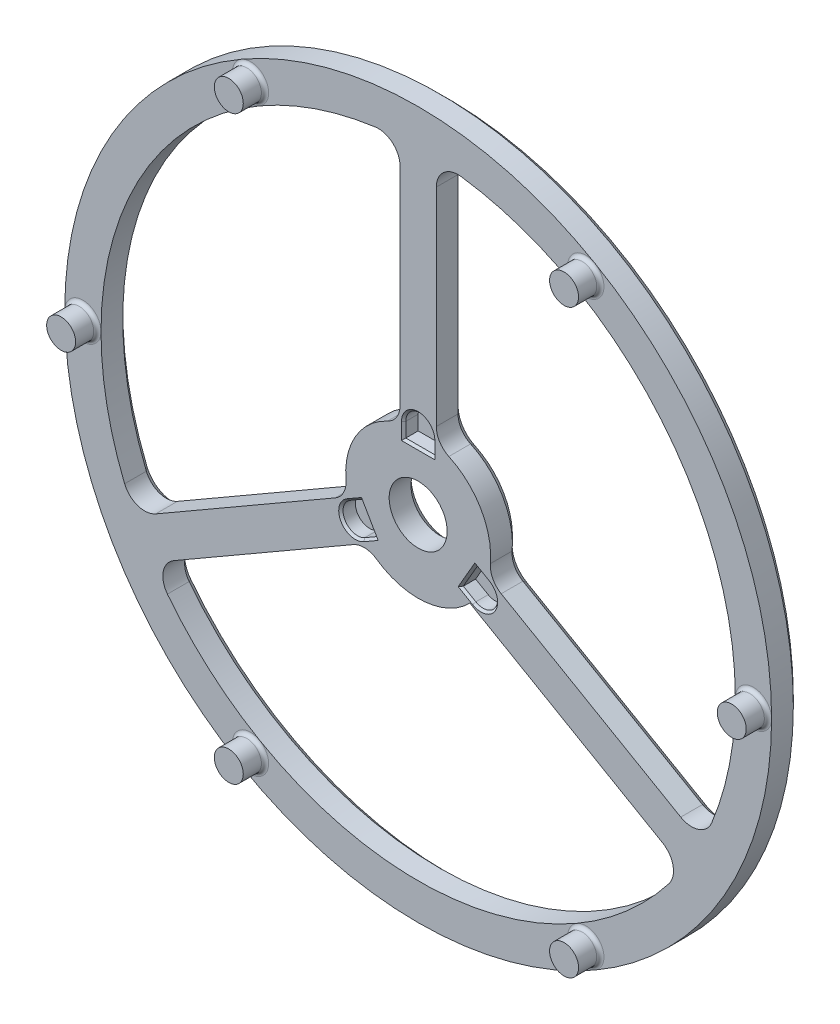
SolidWorks part; units mm, degrees
ref_plane "Front Plane" through (0, 0, 0) normal (0, 0, 1) x (1, 0, 0)
ref_plane "Top Plane" through (0, 0, 0) normal (0, 1, 0) x (1, 0, 0)
ref_plane "Right Plane" through (0, 0, 0) normal (1, 0, 0) x (0, 0, -1)
sketch "Sketch1" plane through (0, 0, 0) normal (0, 0, 1) x (1, 0, 0)
  line L0 (73.1534, -48.0086) -> (14.2705, -14.0126)
  line L2 (-5, 87.357) -> (-5, 19.3649)
  line L4 (5, 87.357) -> (5, 19.3649)
  line L5 (78.1534, -39.3484) -> (19.2705, -5.3523)
  line L6 (-78.1534, -39.3484) -> (-19.2705, -5.3523)
  line L7 (-73.1534, -48.0086) -> (-14.2705, -14.0126)
  circle A0 centre (0, 0) radius 97.5
  arc A1 (-5, 87.357) -> (-78.1534, -39.3484) centre (0, 0) ccw
  arc A2 (-5, 19.3649) -> (-19.2705, -5.3523) centre (0, 0) ccw
  circle A3 centre (0, 0) radius 87.5 construction
  arc A4 (19.2705, -5.3523) -> (5, 19.3649) centre (0, 0) ccw
  arc A5 (-14.2705, -14.0126) -> (14.2705, -14.0126) centre (0, 0) ccw
  arc A6 (78.1534, -39.3484) -> (5, 87.357) centre (0, 0) ccw
  arc A7 (-73.1534, -48.0086) -> (73.1534, -48.0086) centre (0, 0) ccw
  circle A8 centre (0, 0) radius 8
  dimension "D1" = 195
  dimension "D3" = 40
  dimension "D7" = 16
  dimension "D4" = 10
  dimension "D5" = 5
  dimension "D2" = 10
  dimension "D6" = 3
extrude "Boss-Extrude1" add sketch "Sketch1" along normal blind 8
sketch "Sketch2" plane through (0, 0, 8) normal (0, 0, 1) x (1, 0, 0)
  line L0 (0, 0) -> (0, 97.5) construction
  line L1 (0, 0) -> (84.4375, -48.75) construction
  line L2 (0, 0) -> (46.25, 80.1073) construction
  line L3 (0, 0) -> (92.5, 0) construction
  line L4 (0, 0) -> (-46.25, 80.1073) construction
  line L5 (0, 0) -> (46.25, -80.1073) construction
  circle A0 centre (0, 0) radius 97.5 construction
  circle A1 centre (46.25, 80.1073) radius 4
  circle A2 centre (92.5, 0) radius 4
  circle A7 centre (46.25, -80.1073) radius 4
  circle A8 centre (-46.25, -80.1073) radius 4
  circle A9 centre (-92.5, 0) radius 4
  circle A10 centre (-46.25, 80.1073) radius 4
  dimension "D5" = 92.5
  dimension "D6" = 8
  dimension "D7" = 8
  dimension "D10" = 30
  dimension "D1" = 120
  dimension "D2" = 30
  dimension "D3" = 60
  dimension "D4" = 92.5
  dimension "D9" = 30
  dimension "D8" = 3
extrude "Boss-Extrude2" add sketch "Sketch2" along normal blind 6
fillet "Fillet1" radius 1 6 edges at (96.5, 0, 8) (50.25, 80.1073, 8) (50.25, -80.1073, 8) (-42.25, -80.1073, 8) (-88.5, 0, 8) (-42.25, 80.1073, 8)
fillet "Fillet2" radius 6 11 edges at (78.1534, -39.3484, 4) (73.1534, -48.0086, 4) (-73.1534, -48.0086, 4) (-78.1534, -39.3484, 4) (-14.2705, -14.0126, 4) (-19.2705, -5.3523, 4) (19.2705, -5.3523, 4) (5, 19.3649, 4) (-5, 19.3649, 4) (-5, 87.357, 4) (5, 87.357, 4)
chamfer "Chamfer1" distance 2 angle 45 25 edges at (-14.642, -15.3111, 0) (1.839, -19.9153, 0) (40.8529, -29.3599, 0) (70.3226, -48.7461, 0) (0, -87.5, 0) (-70.3226, -48.7461, 0) (-42.6687, -30.4083, 0) (-5.9388, 20.3359, 0) (-17.3205, 10, 0) (-20.5808, -5.0248, 0) (-47.6687, -21.748, 0) (-77.3766, -36.5281, 0) (-75.7772, 43.75, 0) (-7.054, 85.2742, 0) (-5, 52.1563, 0) (97.5, 0, 0) (8, 0, 0) (20.5808, -5.0248, 0) (17.3205, 10, 0) (5.9388, 20.3359, 0) (5, 52.1563, 0) (7.054, 85.2742, 0) (75.7772, 43.75, 0) (77.3766, -36.5281, 0) (47.6687, -21.748, 0)
sketch "Sketch3" plane through (0, 0, 8) normal (0, 0, 1) x (1, 0, 0)
  line L3 (-4, 20) -> (-4, 16)
  line L4 (-4, 16) -> (4, 16)
  line L5 (4, 16) -> (4, 20)
  line L6 (11.8564, -11.4641) -> (15.3205, -13.4641)
  line L7 (15.8564, -4.5359) -> (11.8564, -11.4641)
  line L8 (19.3205, -6.5359) -> (15.8564, -4.5359)
  line L9 (-15.8564, -4.5359) -> (-19.3205, -6.5359)
  line L10 (-11.8564, -11.4641) -> (-15.8564, -4.5359)
  line L11 (-15.3205, -13.4641) -> (-11.8564, -11.4641)
  circle A0 centre (0, 0) radius 20 construction
  arc A1 (4, 20) -> (-4, 20) centre (0, 20) ccw
  arc A2 (15.3205, -13.4641) -> (19.3205, -6.5359) centre (17.3205, -10) ccw
  arc A3 (-19.3205, -6.5359) -> (-15.3205, -13.4641) centre (-17.3205, -10) ccw
  dimension "D1" = 8
  dimension "D4" = 4
  dimension "D2" = 3
  dimension "D3" = 3
extrude "Cut-Extrude1" cut sketch "Sketch3" against normal blind 4
chamfer "Chamfer3" distance 0.6 angle 45 12 edges at (4, 18, 8) (-4, 18, 8) (0, 24, 8) (0, 16, 8) (13.5885, -12.4641, 8) (20.7846, -12, 8) (17.5885, -5.5359, 8) (13.8564, -8, 8) (-13.5885, -12.4641, 8) (-20.7846, -12, 8) (-13.8564, -8, 8) (-17.5885, -5.5359, 8)
